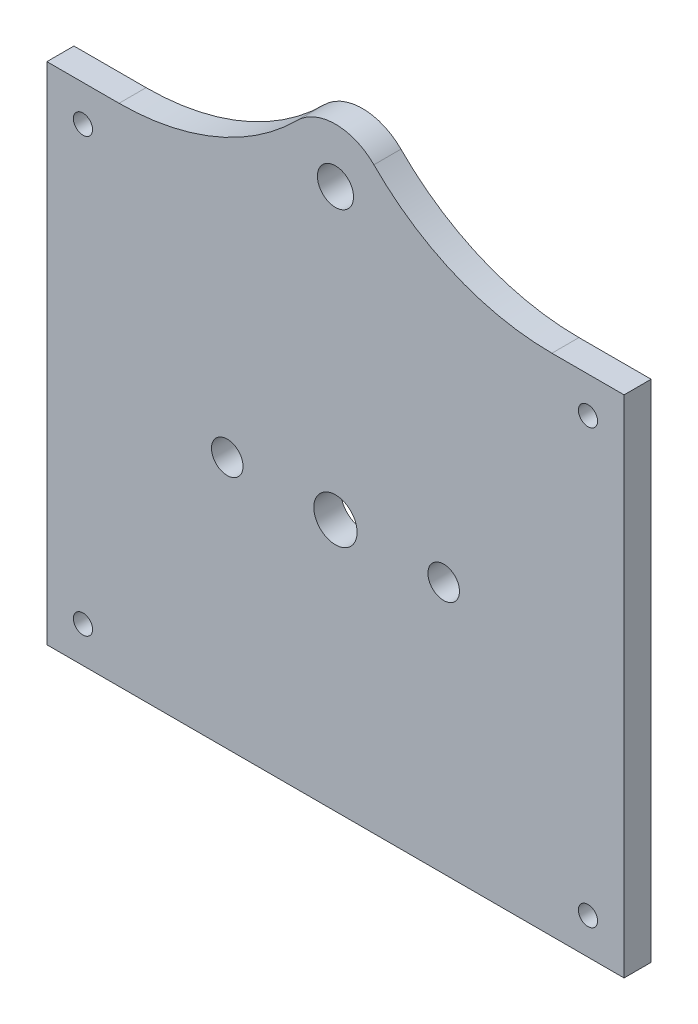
SolidWorks part; units mm, degrees
ref_plane "Front Plane" through (0, 0, 0) normal (0, 0, 1) x (1, 0, 0)
ref_plane "Top Plane" through (0, 0, 0) normal (0, 1, 0) x (1, 0, 0)
ref_plane "Right Plane" through (0, 0, 0) normal (1, 0, 0) x (0, 0, -1)
sketch "Sketch1" plane through (0, 0, 0) normal (0, 0, 1) x (1, 0, 0)
  line L0 (-101.6, -88.9) -> (101.6, -88.9)
  line L1 (101.6, -88.9) -> (101.6, 88.9)
  line L2 (-101.6, -88.9) -> (-101.6, 88.9)
  line L3 (101.6, 88.9) -> (76.2, 88.9)
  line L4 (101.6, -88.9) -> (-101.6, 88.9) construction
  line L5 (-101.6, -88.9) -> (101.6, 88.9) construction
  line L6 (-76.2, 88.9) -> (-101.6, 88.9)
  line L7 (0, 0) -> (0, 101.6) construction
  line L8 (-14.2875, 0) -> (14.2875, 0) construction
  line L9 (38.1, 0) -> (-38.1, 0) construction
  arc A0 (-76.2, 88.9) -> (-13.5266, 115.0139) centre (-76.2, 177.165) ccw
  arc A1 (76.2, 88.9) -> (13.5266, 115.0139) centre (76.2, 177.165) cw
  arc A2 (13.5266, 115.0139) -> (-13.5266, 115.0139) centre (0, 101.6) ccw
  circle A3 centre (-38.1, 0) radius 5.5562
  circle A4 centre (38.1, 0) radius 5.5562
  point P20 (0, 0)
  dimension "D3" = 19.05
  dimension "D8" = 11.1125
  dimension "D1" = 203.2
  dimension "D2" = 177.8
  dimension "D4" = 12.7
  dimension "D5" = 25.4
  dimension "D6" = 101.6
  dimension "D9" = 38.1
extrude "Boss-Extrude1" add sketch "Sketch1" along normal blind 9.525
hole_wizard "1/4 Clearance Hole1" positions "Sketch7" profile "Sketch6" hole size "1/4" standard "ANSI Inch"
sketch "Sketch7" plane through (0, 0, 9.525) normal (0, 0, 1) x (1, 0, 0)
  line L1 (-88.9, -76.2) -> (88.9, -76.2) construction
  line L2 (-88.9, -76.2) -> (-88.9, 76.2) construction
  line L3 (-88.9, 76.2) -> (88.9, 76.2) construction
  line L4 (88.9, -76.2) -> (88.9, 76.2) construction
  line L5 (-88.9, -76.2) -> (88.9, 76.2) construction
  line L6 (-88.9, 76.2) -> (88.9, -76.2) construction
  line L7 (-76.2, 88.9) -> (-101.6, 88.9) construction
  line L8 (-101.6, 88.9) -> (-101.6, -88.9) construction
  point P2 (88.9, 76.2)
  point P265 (-88.9, -76.2)
  point P266 (-88.9, 76.2)
  point P267 (88.9, -76.2)
  point P282 (0, 0)
  dimension "D1" = 12.7
  dimension "D2" = 12.7
sketch "Sketch6" plane through (88.9, 76.2, 9.525) normal (1, 0, 0) x (0, -1, 0)
  line L0 (0, 0) -> (0, 9.525)
  line L1 (0, 9.525) -> (3.3782, 9.525)
  line L2 (3.3782, 9.525) -> (3.3782, 0)
  line L5 (3.3782, 0) -> (0, 0)
  line L11 (0, -6.35) -> (0, 107.95) construction
  dimension "Thru Hole Dia." = 6.7564
  dimension "Thru Hole Depth" = 9.525
hole_wizard "1/2 (0.5000) Dowel Hole2" positions "Sketch9" profile "Sketch8" hole size "1/2" standard "ANSI Inch"
sketch "Sketch9" plane through (0, 0, 9.525) normal (0, 0, 1) x (1, 0, 0)
  point P0 (0, 101.6)
sketch "Sketch8" plane through (0, 101.6, 9.525) normal (1, 0, 0) x (0, -1, 0)
  line L0 (0, 0) -> (0, 9.525)
  line L1 (0, 9.525) -> (6.35, 9.525)
  line L2 (6.35, 9.525) -> (6.35, 0)
  line L5 (6.35, 0) -> (0, 0)
  line L11 (0, -6.35) -> (0, 107.95) construction
  dimension "Thru Hole Dia." = 12.7
  dimension "Thru Hole Depth" = 9.525
sketch "Sketch14" plane through (0, 0, 9.525) normal (0, 0, 1) x (1, 0, 0)
  circle A0 centre (0, 0) radius 7.62
  dimension "D1" = 15.24
extrude "Cut-Extrude1" cut sketch "Sketch14" against normal through all
